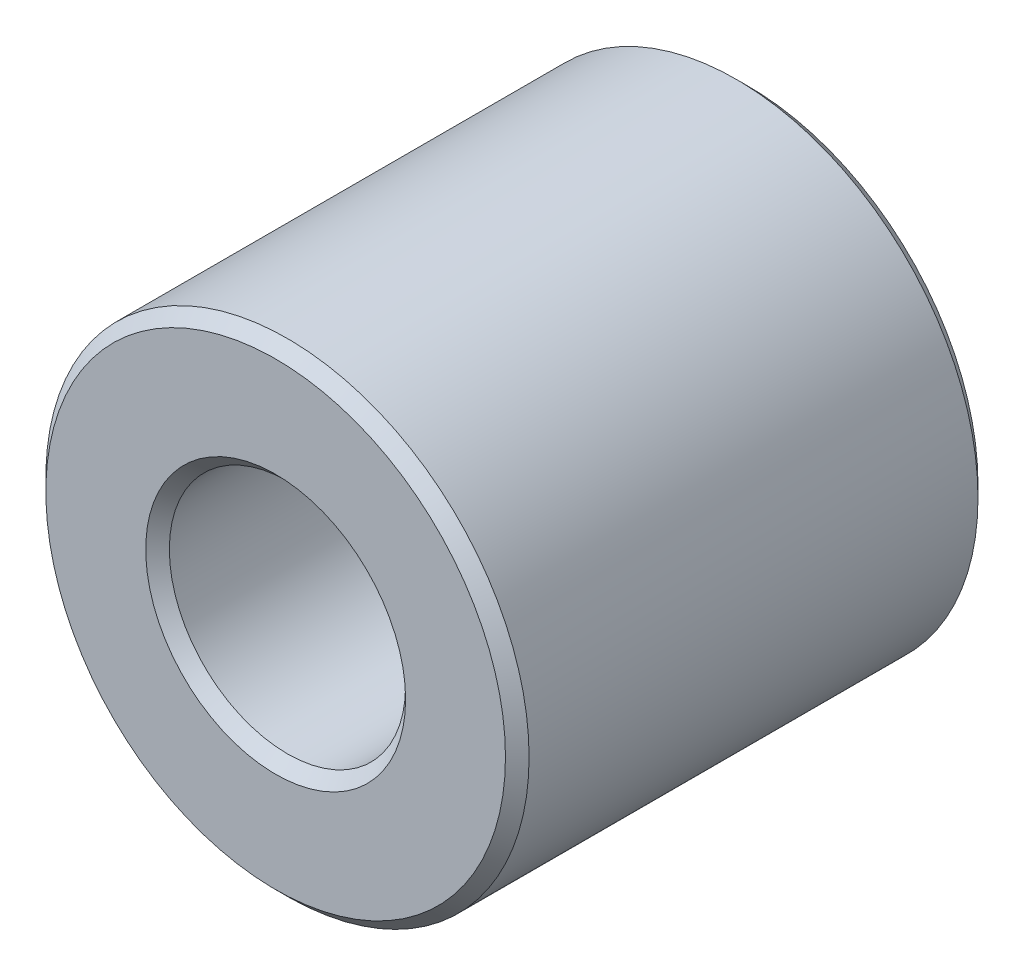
SolidWorks part; units mm, degrees
ref_plane "Front Plane" through (0, 0, 0) normal (0, 0, 1) x (1, 0, 0)
ref_plane "Top Plane" through (0, 0, 0) normal (0, 1, 0) x (1, 0, 0)
ref_plane "Right Plane" through (0, 0, 0) normal (1, 0, 0) x (0, 0, -1)
sketch "Sketch1" plane through (0, 0, 0) normal (0, 0, 1) x (1, 0, 0)
  circle A0 centre (0, 0) radius 11
  circle A1 centre (0, 0) radius 22.5
  dimension "D1" = 22
  dimension "D2" = 45
extrude "Boss-Extrude1" add sketch "Sketch1" along normal mid plane 44
chamfer "Chamfer1" distance 1.1 angle 45 4 edges at (11, 0, -22) (22.5, 0, -22) (11, 0, 22) (22.5, 0, 22)
